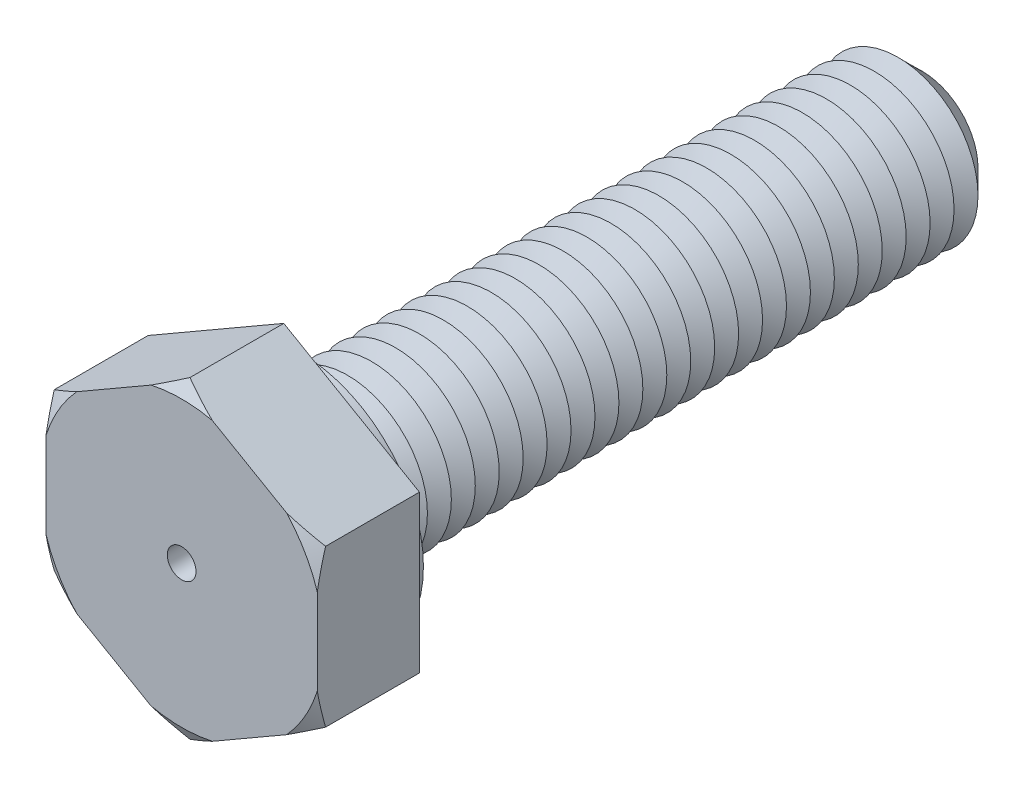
SolidWorks part; units mm, degrees
ref_plane "Front Plane" through (0, 0, 0) normal (0, 0, 1) x (1, 0, 0)
ref_plane "Top Plane" through (0, 0, 0) normal (0, 1, 0) x (1, 0, 0)
ref_plane "Right Plane" through (0, 0, 0) normal (1, 0, 0) x (0, 0, -1)
sketch "Sketch2" plane through (0, 0, 0) normal (0, 0, 1) x (1, 0, 0)
  line L1 (0, 9.815) -> (-8.5, 4.9075)
  line L2 (-8.5, 4.9075) -> (-8.5, -4.9075)
  line L3 (-8.5, -4.9075) -> (0, -9.815)
  line L4 (0, -9.815) -> (8.5, -4.9075)
  line L5 (8.5, -4.9075) -> (8.5, 4.9075)
  line L6 (8.5, 4.9075) -> (0, 9.815)
  circle A0 centre (0, 0) radius 8.5 construction
  dimension "D1" = 17
extrude "Boss-Extrude1" add sketch "Sketch2" along normal blind 6.4
sketch "Sketch3" plane through (0, 0, 0) normal (0, 0, -1) x (-1, 0, 0)
  circle A0 centre (0, 0) radius 5
  dimension "D1" = 10
extrude "Boss-Extrude2" add sketch "Sketch3" along normal blind 40
sketch "Sketch4" plane through (0, 0, 0) normal (0, 0, -1) x (-1, 0, 0)
  circle A0 centre (0, 0) radius 7.75
  dimension "D1" = 15.5
extrude "Boss-Extrude3" add sketch "Sketch4" along normal blind 1
sketch "Sketch5" plane through (0, 0, 0) normal (1, 0, 0) x (0, 0, -1)
  line L0 (-3.2117, 0) -> (6.3192, 0) construction
chamfer "Chamfer1" distance 1.5 angle 45 1 edges at (-5, 0, -40)
sketch "Sketch6" plane through (0, 0, 0) normal (1, 0, 0) x (0, 0, -1)
  line L0 (1, 5) -> (1.75, 3.701)
  line L1 (1.75, 3.701) -> (2.5, 5)
  line L2 (38.5, 5) -> (1, 5) construction
  line L3 (2.5, 5) -> (1, 5)
  dimension "D1" = 1.5
revolve "Cut-Revolve1" cut sketch "Sketch6" angle 360 about L0
pattern_linear "LPattern1" count 25 spacing 1.5 along (0, 0, -1) of "Cut-Revolve1"
sketch "Sketch7" plane through (0, 0, 0) normal (1, 0, 0) x (0, 0, -1)
  line L0 (-6.4, 9.815) -> (-6.4, 8.915)
  line L1 (-6.4, 4.9075) -> (-6.4, 9.815) construction
  line L2 (-6.4, 8.915) -> (-5.8804, 9.815)
  line L3 (-6.4, 9.815) -> (0, 9.815) construction
  line L4 (-5.8804, 9.815) -> (-6.4, 9.815)
  dimension "D1" = 0.9
  dimension "D2" = 30
revolve "Cut-Revolve2" cut sketch "Sketch7" angle 360 about L0
sketch "Sketch8" plane through (0, 0, 6.4) normal (0, 0, 1) x (1, 0, 0)
  circle A0 centre (0, 0) radius 0.9
  dimension "D1" = 1.8
extrude "Cut-Extrude1" cut sketch "Sketch8" against normal up to surface (46.4 mm away)
